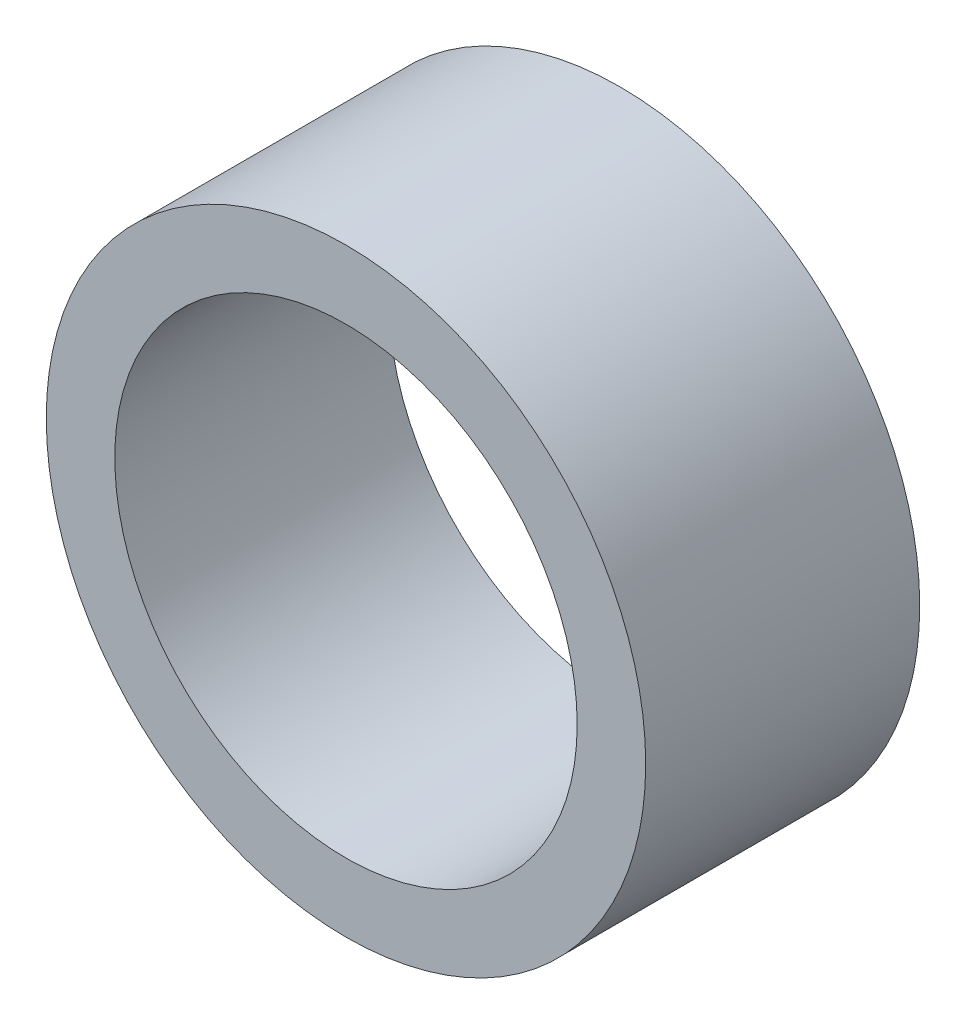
SolidWorks part; units mm, degrees
ref_plane "Plan1" through (0, 0, 0) normal (0, 0, 1) x (1, 0, 0)
ref_plane "Plan2" through (0, 0, 0) normal (0, 1, 0) x (1, 0, 0)
ref_plane "Plan3" through (0, 0, 0) normal (1, 0, 0) x (0, 0, -1)
sketch "Esquisse1" plane through (0, 0, 0) normal (0, 0, 1) x (1, 0, 0)
  circle A0 centre (0, 0) radius 17.5
  dimension "D1" = 35
extrude "Base-Extrusion" add sketch "Esquisse1" along normal blind 16
sketch "Esquisse2" plane through (0, 0, 16) normal (0, 0, 1) x (1, 0, 0)
  circle A0 centre (0, 0) radius 13.5
  dimension "D1" = 27
extrude "Enlèv. mat.-Extru.1" cut sketch "Esquisse2" against normal blind 30
